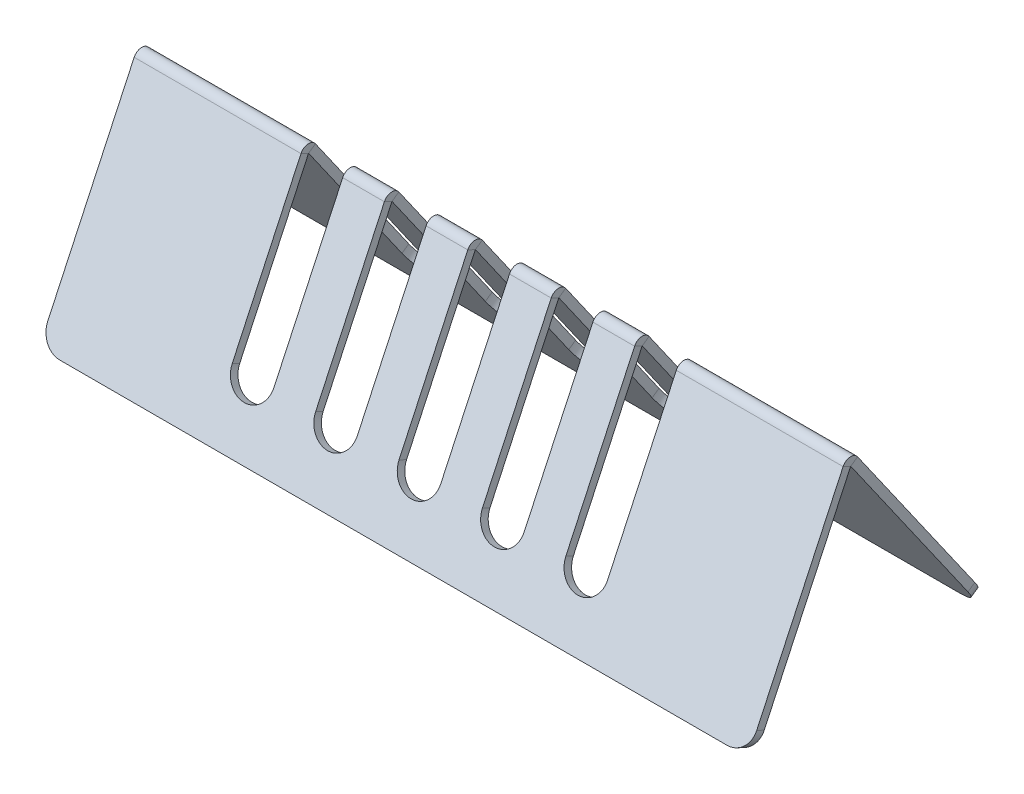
SolidWorks part; units mm, degrees
ref_plane "Front" through (0, 0, 0) normal (0, 0, 1) x (1, 0, 0)
ref_plane "Top" through (0, 0, 0) normal (0, 1, 0) x (1, 0, 0)
ref_plane "Right" through (0, 0, 0) normal (1, 0, 0) x (0, 0, -1)
sketch "Sketch1" plane through (0, 0, 0) normal (0, 1, 0) x (1, 0, 0)
  line L0 (130, 15) -> (130, 100)
  line L1 (5, 0) -> (165, 0)
  line L2 (0, 5) -> (0, 110)
  line L3 (5, 115) -> (165, 115)
  line L4 (170, 5) -> (170, 110)
  line L5 (40, 15) -> (40, 100)
  line L6 (130, 0) -> (130, 115) construction
  line L7 (40, 0) -> (40, 115) construction
  line L8 (170, 0) -> (170, 115) construction
  line L9 (120, 15) -> (120, 100)
  line L10 (0, 0) -> (0, 115) construction
  line L11 (110, 15) -> (110, 100)
  line L13 (100, 15) -> (100, 100)
  line L15 (90, 15) -> (90, 100)
  line L17 (80, 15) -> (80, 100)
  line L19 (70, 15) -> (70, 100)
  line L21 (60, 15) -> (60, 100)
  line L23 (50, 15) -> (50, 100)
  arc A0 (130, 100) -> (120, 100) centre (125, 100) ccw
  arc A1 (110, 100) -> (100, 100) centre (105, 100) ccw
  arc A2 (90, 100) -> (80, 100) centre (85, 100) ccw
  arc A3 (70, 100) -> (60, 100) centre (65, 100) ccw
  arc A4 (50, 100) -> (40, 100) centre (45, 100) ccw
  arc A5 (40, 15) -> (50, 15) centre (45, 15) ccw
  arc A6 (60, 15) -> (70, 15) centre (65, 15) ccw
  arc A7 (80, 15) -> (90, 15) centre (85, 15) ccw
  arc A8 (100, 15) -> (110, 15) centre (105, 15) ccw
  arc A9 (120, 15) -> (130, 15) centre (125, 15) ccw
  arc A10 (170, 110) -> (165, 115) centre (165, 110) ccw
  arc A11 (165, 0) -> (170, 5) centre (165, 5) ccw
  arc A12 (0, 5) -> (5, 0) centre (5, 5) ccw
  arc A13 (5, 115) -> (0, 110) centre (5, 110) ccw
  point P38 (0, 0)
sheet metal parameters "Sheet-Metal1" thickness 2 parameters "D1"=0.01
base flange "Base-Flange1" sketch "Sketch1" thickness 2 reverse thickness direction yes parameters "D1"=0.01
sketch "Sketch3" plane through (0, 2, 0) normal (0, 1, 0) x (-1, 0, 0)
  line L0 (0, -57.5) -> (-170, -57.5)
  line L1 (0, -110) -> (0, -5) construction
  line L2 (-170, -5) -> (-170, -110) construction
sketched bend "Sketched Bend1" parameters "D1"=0.01
bend "SketchBend1" bend radius 0.01 bend angle 120 parameters "D5"=1
move or copy body "Body-Move/Copy1" bodies to move or copy 106
flat pattern "Flat-Pattern1"
sketch "Bend-Lines1" plane through (0, 34.4907, -49.2578) normal (0, -0.5736, 0.8192) x (1, 0, 0)
  line L0 (170, 33.8107) -> (0, 33.8107) construction
bend of the flat pattern "Flatten-<SketchBend1>1"
